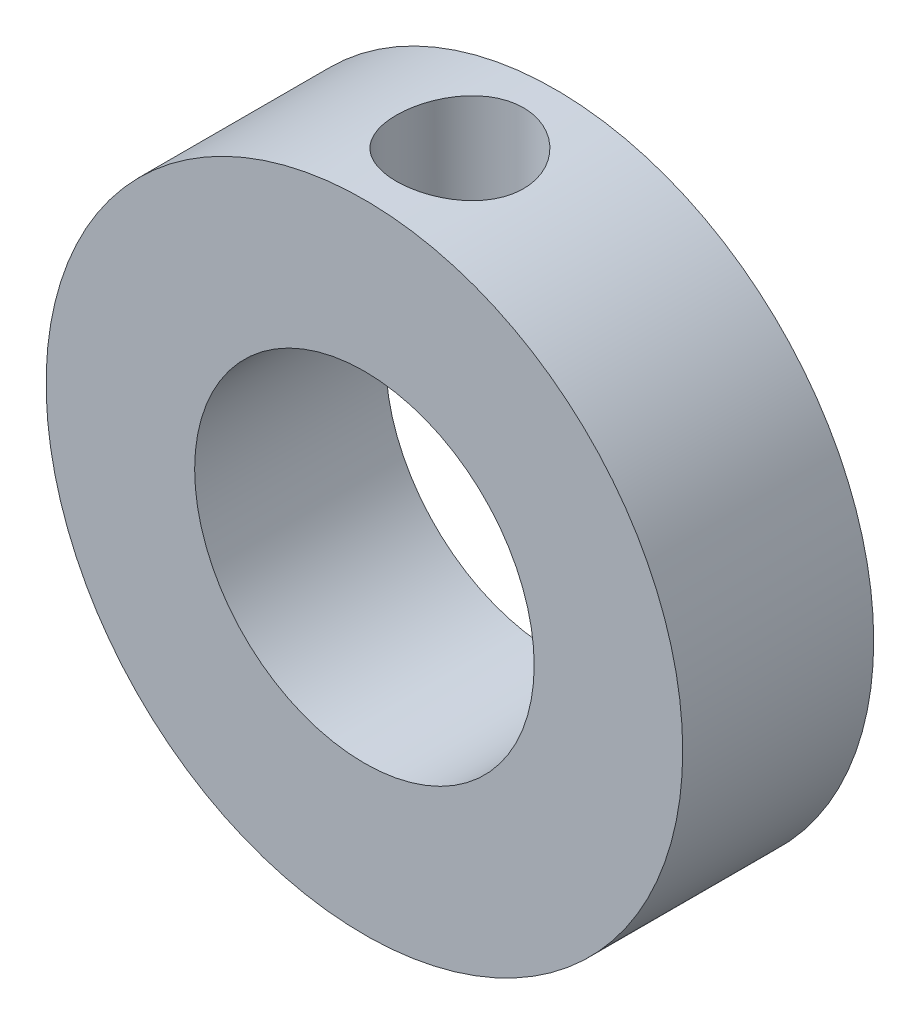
SolidWorks part; units mm, degrees
ref_plane "Front" through (0, 0, 0) normal (0, 0, 1) x (1, 0, 0)
ref_plane "Top" through (0, 0, 0) normal (0, 1, 0) x (1, 0, 0)
ref_plane "Right" through (0, 0, 0) normal (1, 0, 0) x (0, 0, -1)
sketch "Sketch1" plane through (0, 0, 0) normal (0, 0, 1) x (1, 0, 0)
  circle A0 centre (0, 0) radius 15
  circle A1 centre (0, 0) radius 8
extrude "Extrude1" add sketch "Sketch1" along normal mid plane 9
ref_plane "Plane1" through (0, 15, 0) normal (0, 1, 0) x (-1, 0, 0)
sketch "Sketch2" plane through (0, 15, 0) normal (0, 1, 0) x (-1, 0, 0)
  line L3 (0, 4.5) -> (0, -4.5) construction
  line L4 (15, 4.5) -> (-15, 4.5) construction
  line L5 (-15, -4.5) -> (15, -4.5) construction
  circle A0 centre (0, 0) radius 3
extrude "Cut-Extrude1" cut sketch "Sketch2" against normal blind 9
